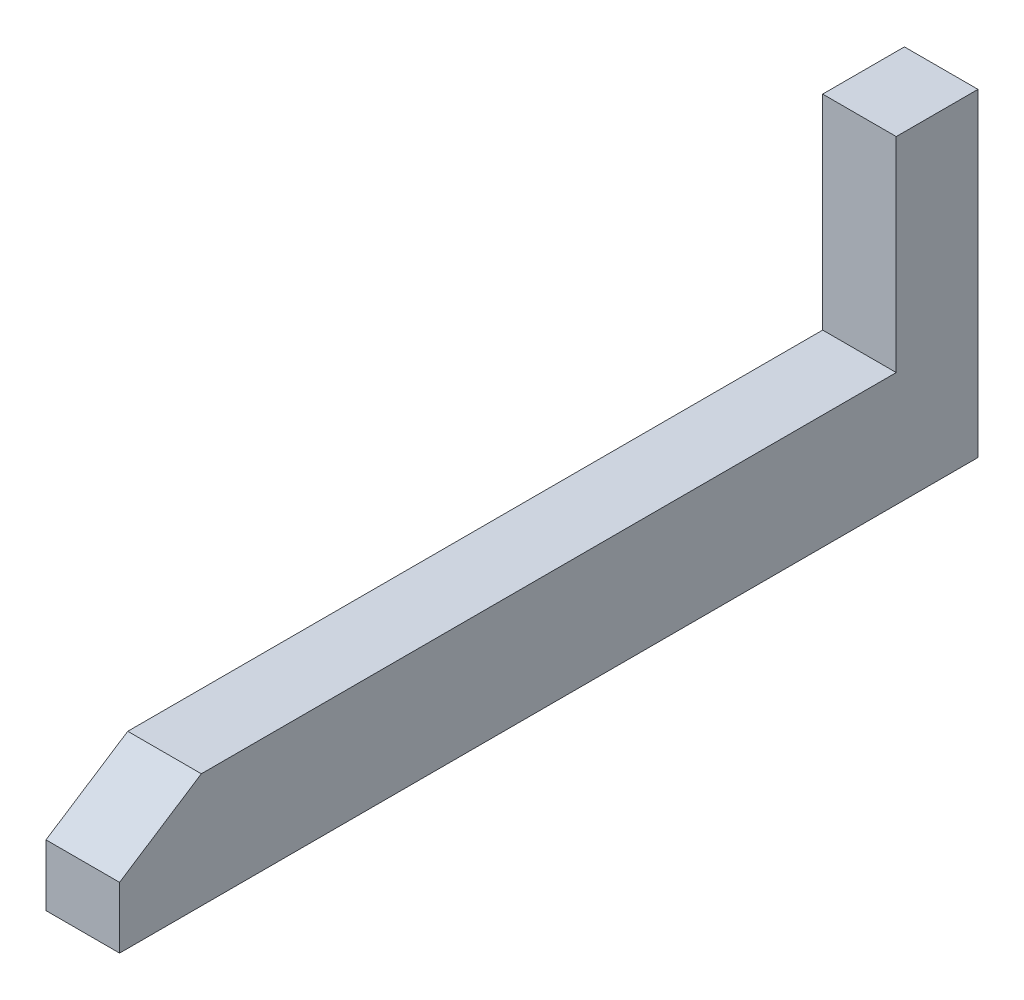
SolidWorks part; units mm, degrees
ref_plane "Спереди" through (0, 0, 0) normal (0, 0, 1) x (1, 0, 0)
ref_plane "Сверху" through (0, 0, 0) normal (0, 1, 0) x (1, 0, 0)
ref_plane "Справа" through (0, 0, 0) normal (1, 0, 0) x (0, 0, -1)
sketch "Эскиз1" plane through (0, 0, 0) normal (1, 0, 0) x (0, 0, -1)
  line L0 (-9.4939, -0.3714) -> (-7.4939, 0.9286)
  line L1 (-9.4939, 0.9286) -> (11.5061, 0.9286)
  line L2 (-9.4939, 0.9286) -> (-9.4939, -1.8714)
  line L3 (-9.4939, -1.8714) -> (11.5061, -1.8714)
  line L4 (11.5061, 0.9286) -> (11.5061, -1.8714)
  line L5 (9.5061, 5.9286) -> (11.5061, 5.9286)
  line L6 (9.5061, 5.9286) -> (9.5061, 0.9286)
  line L7 (9.5061, 0.9286) -> (11.5061, 0.9286)
  line L8 (11.5061, 5.9286) -> (11.5061, 0.9286)
  dimension "D1" = 21
  dimension "D2" = 2.8
  dimension "D3" = 2
  dimension "D4" = 1.5
  dimension "D5" = 2
  dimension "D6" = 5
extrude "Бобышка-Вытянуть1" add sketch "Эскиз1" along normal blind 1.8 contours L4 L1 L2 L3 | L8 L5 L6 L1
